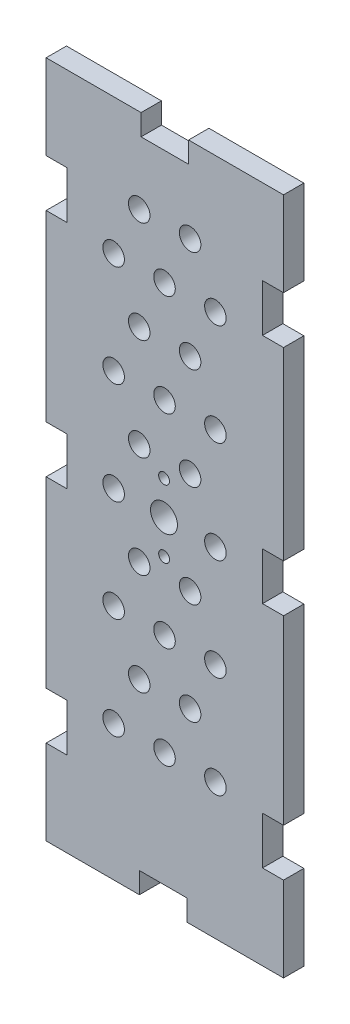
SolidWorks part; units mm, degrees
ref_plane "Front Plane" through (0, 0, 0) normal (0, 0, 1) x (1, 0, 0)
ref_plane "Top Plane" through (0, 0, 0) normal (0, 1, 0) x (1, 0, 0)
ref_plane "Right Plane" through (0, 0, 0) normal (1, 0, 0) x (0, 0, -1)
sketch "Sketch1" plane through (0, 0, 0) normal (0, 0, 1) x (1, 0, 0)
  line L1 (0, 0) -> (70, 0)
  line L2 (0, 0) -> (0, 200)
  line L3 (0, 200) -> (70, 200)
  line L4 (70, 0) -> (70, 200)
  dimension "D1" = 200
  dimension "D2" = 70
extrude "Boss-Extrude2" add sketch "Sketch1" along normal blind 6
sketch "Sketch4" plane through (0, 0, 6) normal (0, 0, 1) x (1, 0, 0)
  line L0 (0, 0) -> (70, 0) construction
  line L1 (70, 0) -> (70, 200) construction
  line L2 (70, 200) -> (0, 200) construction
  line L3 (0, 200) -> (0, 0) construction
  line B0 (28, 193.8) -> (42, 193.8)
  line B1 (42, 193.8) -> (42, 200)
  line B2 (42, 200) -> (28, 200)
  line B3 (28, 200) -> (28, 193.8)
  line B4 (27.5, 0) -> (41.5, 0)
  line B5 (41.5, 0) -> (41.5, 6.2)
  line B6 (41.5, 6.2) -> (27.5, 6.2)
  line B7 (27.5, 6.2) -> (27.5, 0)
  line B8 (6.2, 161) -> (6.2, 175)
  line B9 (6.2, 175) -> (0, 175)
  line B10 (0, 175) -> (0, 161)
  line B11 (0, 161) -> (6.2, 161)
  line B12 (0, 168) -> (6.2, 168) construction
  line B13 (6.2, 93) -> (6.2, 107)
  line B14 (6.2, 107) -> (0, 107)
  line B15 (0, 107) -> (0, 93)
  line B16 (0, 93) -> (6.2, 93)
  line B17 (0, 100) -> (6.2, 100) construction
  line B18 (6.2, 25) -> (6.2, 39)
  line B19 (6.2, 39) -> (0, 39)
  line B20 (0, 39) -> (0, 25)
  line B21 (0, 25) -> (6.2, 25)
  line B22 (0, 32) -> (6.2, 32) construction
  line B23 (70, 161) -> (70, 175)
  line B24 (70, 175) -> (63.8, 175)
  line B25 (63.8, 175) -> (63.8, 161)
  line B26 (63.8, 161) -> (70, 161)
  line B27 (63.8, 168) -> (70, 168) construction
  line B28 (70, 92.5) -> (70, 106.5)
  line B29 (70, 106.5) -> (63.8, 106.5)
  line B30 (63.8, 106.5) -> (63.8, 92.5)
  line B31 (63.8, 92.5) -> (70, 92.5)
  line B32 (63.8, 99.5) -> (70, 99.5) construction
  line B33 (70, 25) -> (70, 39)
  line B34 (70, 39) -> (63.8, 39)
  line B35 (63.8, 39) -> (63.8, 25)
  line B36 (63.8, 25) -> (70, 25)
  line B37 (63.8, 32) -> (70, 32) construction
  dimension "D1" = 32
  dimension "D2" = 100
  dimension "D3" = 32
  dimension "D4" = 32
  dimension "D5" = 32
sketch_block_instance "Block-laser-cut-slot-15x6-1"
sketch_block "Block1" parameters "D1"=14, "D2"=6.2
sketch_block_instance "Block1-1"
sketch_block_instance "Block1-2"
sketch_block_instance "Block1-3"
sketch_block_instance "Block1-4"
sketch_block_instance "Block1-5"
sketch_block_instance "Block1-6"
sketch_block_instance "Block1-7"
extrude "Cut-Extrude1" cut sketch "Sketch4" against normal blind 6
sketch "Sketch5" plane through (0, 0, 6) normal (0, 0, 1) x (1, 0, 0)
  line L0 (27.4499, 175) -> (42.4499, 175) construction
  line L1 (35, 193.8) -> (34.5, 6.2) construction
  line L2 (28, 193.8) -> (42, 193.8) construction
  line L3 (41.5, 6.2) -> (27.5, 6.2) construction
  line L4 (27.4499, 145) -> (42.4499, 145) construction
  line L5 (35, 163.8) -> (34.5, -23.8) construction
  line L6 (27.4499, 115) -> (42.4499, 115) construction
  line L7 (35, 133.8) -> (34.5, -53.8) construction
  line L8 (27.4499, 85) -> (42.4499, 85) construction
  line L9 (35, 103.8) -> (34.5, -83.8) construction
  line L10 (27.4499, 55) -> (42.4499, 55) construction
  line L11 (35, 73.8) -> (34.5, -113.8) construction
  line L12 (34.75, 100) -> (19.9099, 100) construction
  line L13 (28, 200) -> (0, 200) construction
  circle A0 centre (19.9099, 160) radius 3.175
  circle A1 centre (34.9099, 160) radius 3.175
  circle A9 centre (27.4499, 175) radius 3.175
  circle A10 centre (49.9099, 160) radius 3.175
  circle A11 centre (42.4499, 175) radius 3.175
  circle A12 centre (19.9099, 130) radius 3.175
  circle A13 centre (34.9099, 130) radius 3.175
  circle A14 centre (27.4499, 145) radius 3.175
  circle A15 centre (49.9099, 130) radius 3.175
  circle A16 centre (42.4499, 145) radius 3.175
  circle A17 centre (19.9099, 100) radius 3.175
  circle A18 centre (34.75, 100) radius 3.975
  circle A19 centre (27.4499, 115) radius 3.175
  circle A20 centre (49.9099, 100) radius 3.175
  circle A21 centre (42.4499, 115) radius 3.175
  circle A22 centre (19.9099, 70) radius 3.175
  circle A23 centre (34.9099, 70) radius 3.175
  circle A24 centre (27.4499, 85) radius 3.175
  circle A25 centre (49.9099, 70) radius 3.175
  circle A26 centre (42.4499, 85) radius 3.175
  circle A27 centre (19.9099, 40) radius 3.175
  circle A28 centre (34.9099, 40) radius 3.175
  circle A29 centre (27.4499, 55) radius 3.175
  circle A30 centre (49.9099, 40) radius 3.175
  circle A31 centre (42.4499, 55) radius 3.175
  circle A32 centre (34.7767, 110) radius 1.6
  circle A33 centre (34.7767, 90) radius 1.6
  point P12 (34.9499, 175)
  dimension "D1" = 6.35
  dimension "D4" = 15
  dimension "D6" = 7.95
  dimension "D7" = 3.2
  dimension "D2" = 15
  dimension "D3" = 15
  dimension "D5" = 15
  dimension "D8" = 100
  dimension "D9" = 10
extrude "Cut-Extrude2" cut sketch "Sketch5" against normal blind 6
